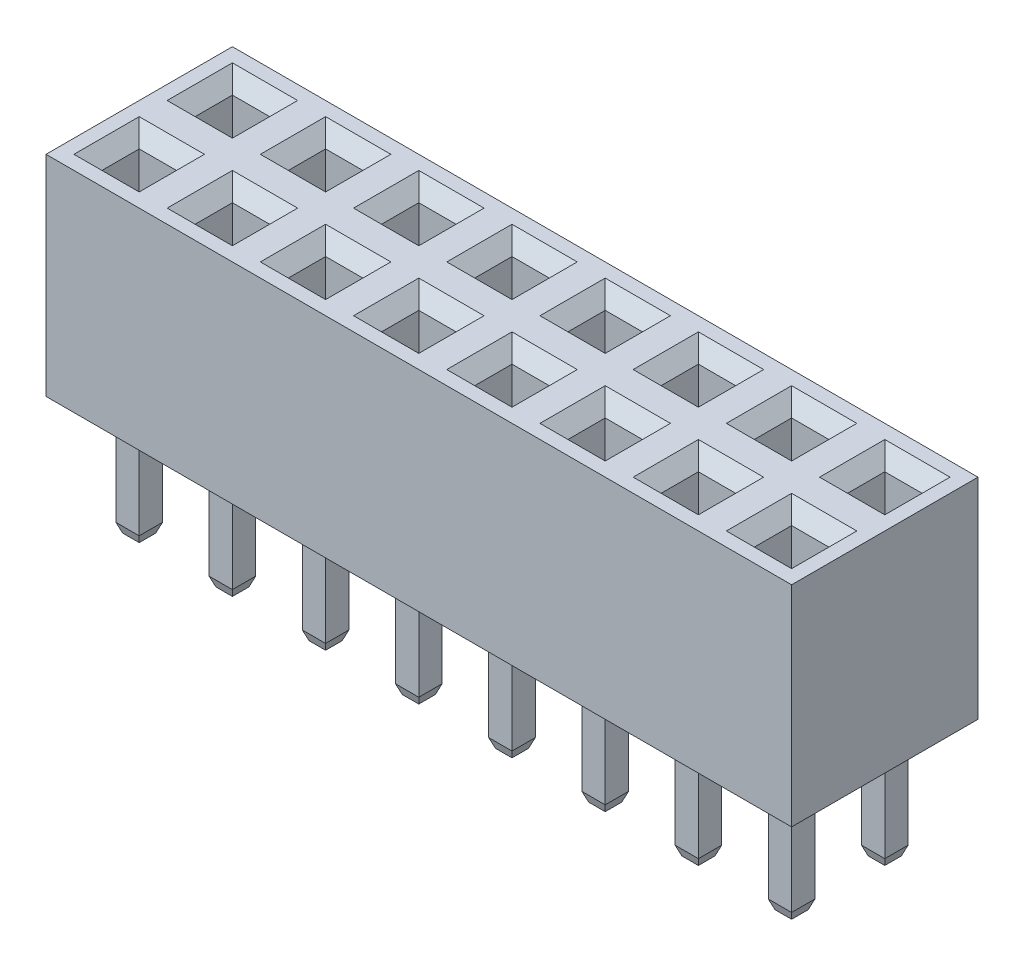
SolidWorks part; units mm, degrees
ref_plane "Front" through (0, 0, 0) normal (0, 0, 1) x (1, 0, 0)
ref_plane "Top" through (0, 0, 0) normal (0, 1, 0) x (1, 0, 0)
ref_plane "Right" through (0, 0, 0) normal (1, 0, 0) x (0, 0, -1)
sketch "Эскиз2" plane through (0, 0, 0) normal (0, 1, 0) x (1, 0, 0)
  line L1 (-1, 3) -> (1, 3)
  line L2 (-1, 3) -> (-1, -1)
  line L3 (-1, -1) -> (1, -1)
  line L4 (1, 3) -> (1, -1)
  line L8 (0, -1) -> (0, 3) construction
  dimension "D1" = 2
  dimension "D2" = 4
  dimension "D3" = 1
extrude "Вытянуть2" add sketch "Эскиз2" along normal blind 4.5
sketch "Эскиз3" plane through (0, 4.5, 0) normal (0, 1, 0) x (-1, 0, 0)
  line L0 (0, 0.4) -> (0, -0.4) construction
  line L1 (0.4, 0.4) -> (-0.4, 0.4)
  line L2 (0.4, 0.4) -> (0.4, -0.4)
  line L3 (0.4, -0.4) -> (-0.4, -0.4)
  line L4 (-0.4, 0.4) -> (-0.4, -0.4)
  line L5 (0.4, -1.6) -> (-0.4, -1.6)
  line L6 (0.4, -1.6) -> (0.4, -2.4)
  line L7 (0.4, -2.4) -> (-0.4, -2.4)
  line L8 (-0.4, -1.6) -> (-0.4, -2.4)
  line L9 (0, -1.6) -> (0, -2.4) construction
  dimension "D1" = 0.8
  dimension "D2" = 2
extrude "Вырез-Вытянуть1" cut sketch "Эскиз3" against normal blind 4
chamfer "Фаска3" distance 0.3 angle 45 8 edges at (-0.4, 4.5, 0) (0, 4.5, 0.4) (0.4, 4.5, 0) (0, 4.5, -0.4) (0, 4.5, -1.6) (0.4, 4.5, -2) (0, 4.5, -2.4) (-0.4, 4.5, -2)
sketch "Эскиз1" plane through (0, 0, 0) normal (0, 1, 0) x (1, 0, 0)
  line L0 (-0.25, 0) -> (0.25, 0) construction
  line L1 (-0.25, 0.25) -> (0.25, 0.25)
  line L2 (-0.25, 0.25) -> (-0.25, -0.25)
  line L3 (-0.25, -0.25) -> (0.25, -0.25)
  line L4 (0.25, 0.25) -> (0.25, -0.25)
  line L5 (-0.25, 2.25) -> (0.25, 2.25)
  line L6 (-0.25, 2.25) -> (-0.25, 1.75)
  line L7 (-0.25, 1.75) -> (0.25, 1.75)
  line L8 (0.25, 2.25) -> (0.25, 1.75)
  line L9 (-0.25, 2) -> (0.25, 2) construction
  dimension "D1" = 0.5
  dimension "D2" = 2
extrude "Вытянуть1" add sketch "Эскиз1" against normal blind 2.54
chamfer "Фаска1" distance 0.2 angle 20 8 edges at (0, -2.54, -0.25) (0.25, -2.54, 0) (0, -2.54, 0.25) (-0.25, -2.54, 0) (0, -2.54, -1.75) (0.25, -2.54, -2) (0, -2.54, -2.25) (-0.25, -2.54, -2)
pattern_linear "Линейный массив1" count 8 spacing 2 along (-1, 0, 0) of "Вытянуть2", "Вырез-Вытянуть1", "Фаска3"
pattern_linear "Линейный массив3" count 100 spacing 2 along (-1, 0, 0) of "Вытянуть1", "Фаска1"
